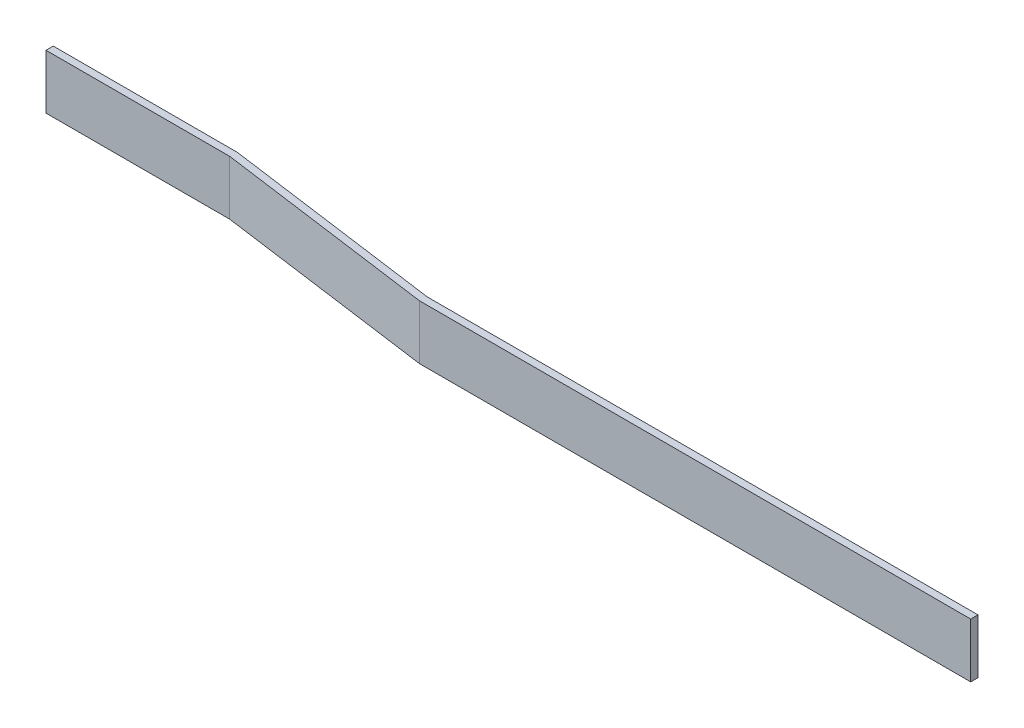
SolidWorks part; units mm, degrees
ref_plane "Vorderansicht" through (0, 0, 0) normal (0, 0, 1) x (1, 0, 0)
ref_plane "Oben" through (0, 0, 0) normal (0, 1, 0) x (1, 0, 0)
ref_plane "Rechts" through (0, 0, 0) normal (1, 0, 0) x (0, 0, -1)
sketch "Skizze1" plane through (0, 0, 0) normal (0, 1, 0) x (1, 0, 0)
  line L3 (-73.6462, 11.3121) -> (-23.0351, 11.3121)
  line L4 (-23.0351, 11.3121) -> (37.5294, 2.9911)
  line L5 (37.5294, 2.9911) -> (189.4028, 2.9911)
extrude "Linear-Austragen-Dünn1" add sketch "Skizze1" along normal blind 15 thin contours L3 L4 L5
